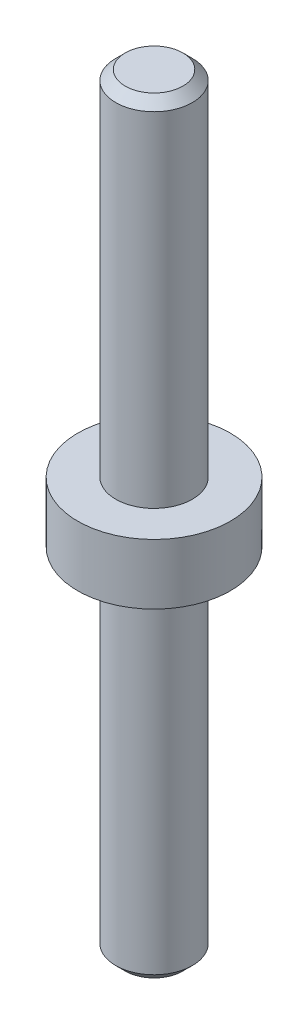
SolidWorks part; units mm, degrees
ref_plane "Front" through (0, 0, 0) normal (0, 0, 1) x (1, 0, 0)
ref_plane "Top" through (0, 0, 0) normal (0, 1, 0) x (1, 0, 0)
ref_plane "Right" through (0, 0, 0) normal (1, 0, 0) x (0, 0, -1)
sketch "Sketch1" plane through (0, 0, 0) normal (0, 0, 1) x (1, 0, 0)
  line L0 (0, 0) -> (0, 31.75)
  line L1 (0, 31.75) -> (-3.175, 31.75)
  line L3 (-3.175, 31.75) -> (-3.175, 0)
  line L4 (-3.175, 0) -> (0, 0)
  line L5 (0, 31.75) -> (0, 86.0204) construction
  dimension "D1" = 6.35
  dimension "D2" = 31.75
revolve "Revolve1" add sketch "Sketch1" angle 360 about L5
chamfer "Chamfer1" distance 0.7874 angle 45 1 edges at (0, 31.75, -3.175)
mirror "Mirror1" about plane through (-3.175, 0, 0) normal (0, 1, 0)
sketch "Sketch2" plane through (0, 0, 0) normal (0, 0, 1) x (1, 0, 0)
  line L0 (-3.175, 30.9626) -> (-3.175, -30.9626) construction
  line L1 (-3.175, 2.5) -> (-6.325, 2.5)
  line L2 (-3.175, 2.5) -> (-3.175, -2.5)
  line L3 (-3.175, -2.5) -> (-6.325, -2.5)
  line L4 (-6.325, 2.5) -> (-6.325, -2.5)
  line L5 (0, 0) -> (-3.175, 0) construction
  line L6 (0, 0) -> (0, 10.594) construction
  dimension "D1" = 6.325
  dimension "D2" = 5
revolve "Revolve2" add sketch "Sketch2" angle 360 about L6
